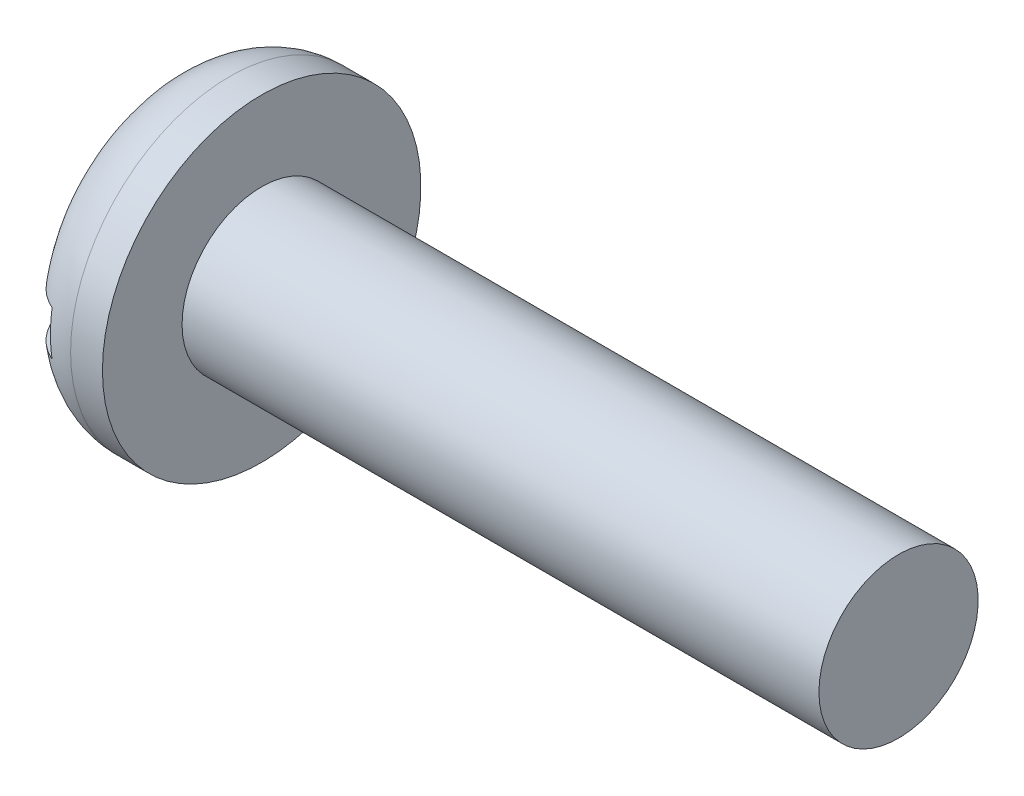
SolidWorks part; units mm, degrees
ref_plane "Plane1" through (0, 0, 0) normal (0, 0, 1) x (1, 0, 0)
ref_plane "Plane2" through (0, 0, 0) normal (0, 1, 0) x (1, 0, 0)
ref_plane "Plane3" through (0, 0, 0) normal (1, 0, 0) x (0, 0, -1)
sketch "BodySke" plane through (0, 0, 0) normal (0, 0, 1) x (1, 0, 0)
  line L0 (6, 5) -> (6, 10)
  line L1 (0, 0) -> (0, 6)
  line L2 (-25.4, 0) -> (127, 0) construction
  line L3 (46, 0) -> (0, 0)
  line L4 (6, 5) -> (46, 5)
  line L5 (46, 5) -> (46, 0)
  line L6 (4, 10) -> (6, 10)
  line L7 (6, -5) -> (46, -5) construction
  line L8 (0, -10) -> (6, -10) construction
  line L9 (7.5, 6.5875) -> (7.5, -2.9375) construction
  line L10 (6, 6.35) -> (6, -3.175) construction
  arc A0 (0, 6) -> (4, 10) centre (4, 6) cw
  point P15 (0, 10)
  dimension "Head_fillet_rad" = 4
  dimension "Head_ht" = 6
  dimension "Diameter" = 10
  dimension "Length" = 40
  dimension "Head_dia" = 20
  dimension "Advance" = 1.5
  dimension "Thread_nom" = 40
revolve "Base-Revolve" add sketch "BodySke" angle 360 about L2
sketch "Sketch2" plane through (0, 0, 0) normal (1, 0, 0) x (0, 0, -1)
  line L0 (10, -1.4) -> (-10, -1.4)
  line L1 (10, -1.4) -> (10, 1.4)
  line L2 (-10, 1.4) -> (10, 1.4)
  line L3 (-10, 1.4) -> (-10, -1.4)
  dimension "D1" = 20
  dimension "D2" = 10
  dimension "Slot_width" = 2.8
  dimension "D3" = 1.4
extrude "Slot" cut sketch "Sketch2" along normal blind 2.4
sketch "ThdSchSke" plane through (0, 0, 0) normal (0, 0, 1) x (1, 0, 0)
  line L0 (7.5, -4.172) -> (6.9202, -5)
  line L1 (7.5, -4.172) -> (8.0798, -5)
  line L2 (8.0798, -5) -> (8.0798, -6.25)
  line L3 (-3.175, 0) -> (5.1513, 0) construction
  line L5 (8.0798, -6.25) -> (6.9202, -6.25)
  line L6 (6.9202, -6.25) -> (6.9202, -5)
  dimension "Thread_minor" = 8.344
  dimension "Diameter" = 10
  dimension "Start" = 7.5
  dimension "SideAngle" = 55
  dimension "VeeAngle" = 70
  dimension "Overcut" = 12.5
revolve "ThreadSchematic" [suppressed] cut sketch "ThdSchSke" angle 360 about L3
pattern_linear "ThdSchPat" [suppressed]
equation "\"D1@Sketch2\" = \"Head_dia@BodySke\""
equation "\"D2@Sketch2\" = \"D1@Sketch2\" / 2"
equation "\"D3@Sketch2\" = \"Slot_width@Sketch2\" / 2"
equation "\"Thread_length@ThreadCosmetic\" = ((sgn( (\"Length@BodySke\" - \"Advance@BodySke\" ) - \"Thread_nom@BodySke\" )-1)*( (\"Length@BodySke\" - \"Advance@BodySke\" ) - \"Thread_nom@BodySke\" ))/-2+ \"Thread_nom@BodySke\""
equation "\"Thread_minor@ThdSchSke\" = \"Thread_minor@ThreadCosmetic\""
equation "\"Diameter@ThdSchSke\" = \"Diameter@BodySke\""
equation "\"Overcut@ThdSchSke\" = \"Diameter@BodySke\" * 1.25"
equation "\"Start@ThdSchSke\" = \"Head_ht@BodySke\" + \"Length@BodySke\" - \"Thread_length@ThreadCosmetic\"  '---Non-countersunk---"
equation "\"Num_threads@ThdSchPat\" = int( \"Thread_length@ThreadCosmetic\" / \"Advance@BodySke\" + 0.999 )  + 1"
equation "\"Advance@ThdSchPat\" = \"Thread_length@ThreadCosmetic\" /  (\"Num_threads@ThdSchPat\" - 1) 'relax it"
